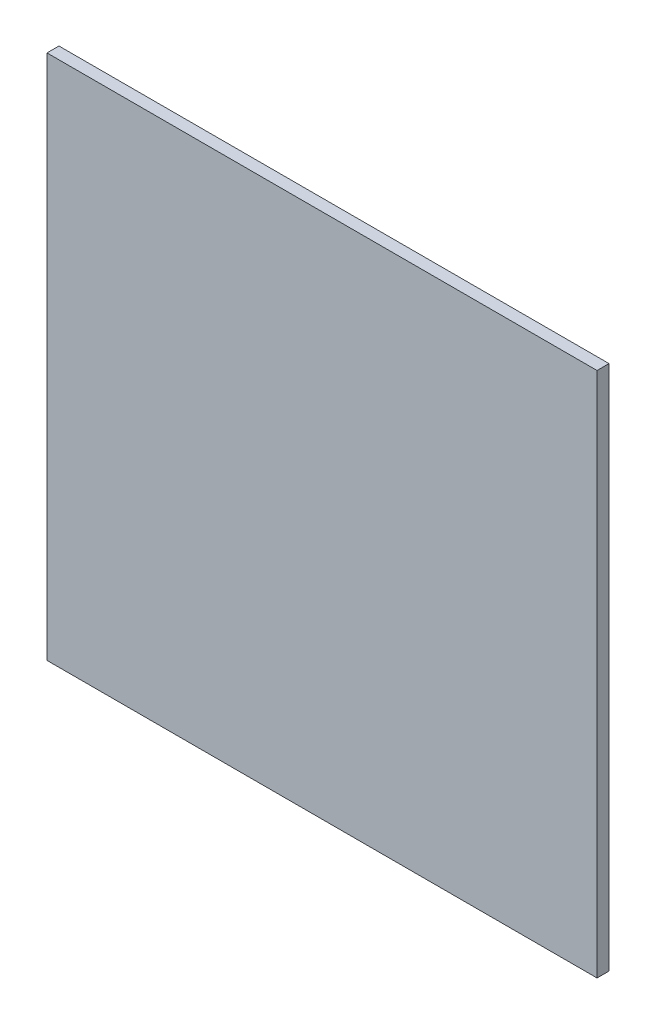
SolidWorks part; units mm, degrees
ref_plane "Plan de face" through (0, 0, 0) normal (0, 0, 1) x (1, 0, 0)
ref_plane "Plan de dessus" through (0, 0, 0) normal (0, 1, 0) x (1, 0, 0)
ref_plane "Plan de droite" through (0, 0, 0) normal (1, 0, 0) x (0, 0, -1)
sketch "Esquisse1" plane through (0, 0, 0) normal (0, 0, 1) x (1, 0, 0)
  line L1 (0, 0) -> (115, 0)
  line L2 (0, 0) -> (0, 110)
  line L3 (0, 110) -> (115, 110)
  line L4 (115, 0) -> (115, 110)
  dimension "D1" = 110
  dimension "D2" = 115
sheet metal parameters "Tôlerie 1" thickness 2.5 parameters "D1"=2.5
base flange "Tôle de base pliée1" sketch "Esquisse1" thickness 2.5 reverse thickness direction yes parameters "D1"=2.5
fillet "Congé1" [suppressed] radius 5
flat pattern "Etat déplié1"
sketch "Lignes de pliage1" plane through (0, 0, 0) normal (0, 1, 0) x (-1, 0, 0)
